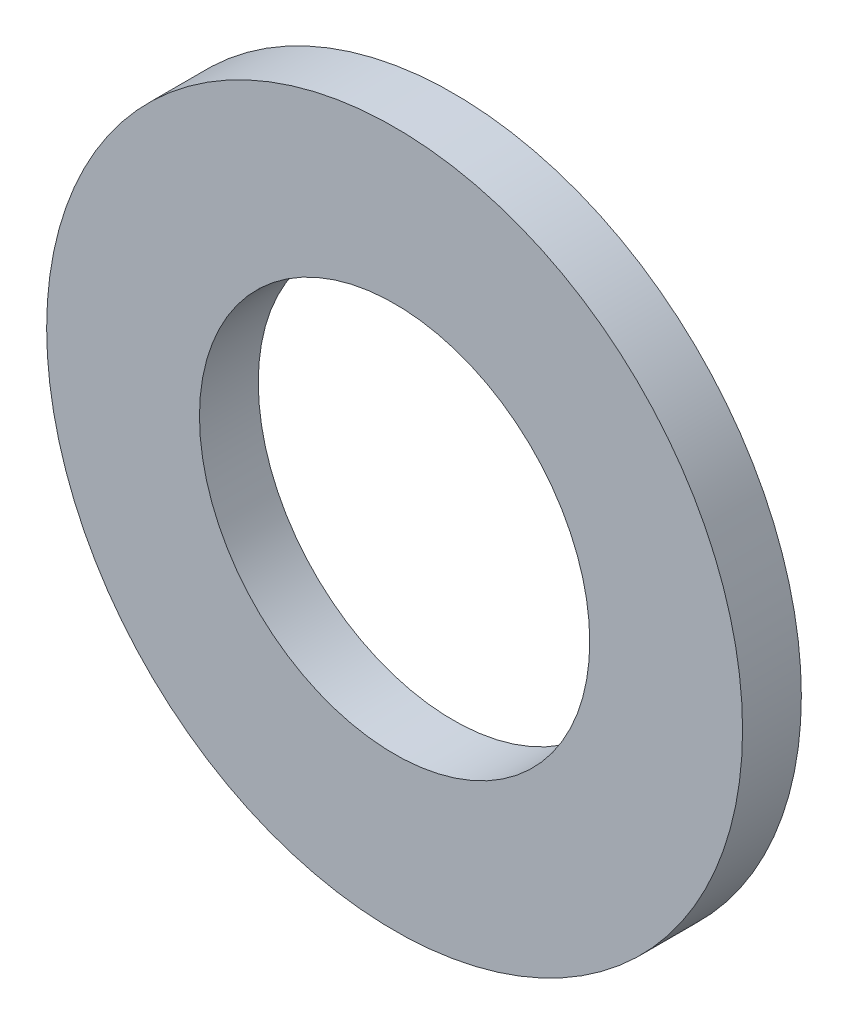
SolidWorks part; units mm, degrees
ref_plane "Front Plane" through (0, 0, 0) normal (0, 0, 1) x (1, 0, 0)
ref_plane "Top Plane" through (0, 0, 0) normal (0, 1, 0) x (1, 0, 0)
ref_plane "Right Plane" through (0, 0, 0) normal (1, 0, 0) x (0, 0, -1)
sketch "Sketch1" plane through (0, 0, 0) normal (0, 0, 1) x (1, 0, 0)
  circle A0 centre (0, 0) radius 18.796
  dimension "D1" = 37.592
extrude "Extrude1" add sketch "Sketch1" along normal blind 3.175
sketch "Sketch2" plane through (0, 0, 3.175) normal (0, 0, 1) x (1, 0, 0)
  circle A1 centre (0, 0) radius 10.541
  dimension "D2" = 21.082
extrude "Cut-Extrude1" cut sketch "Sketch2" against normal through all
